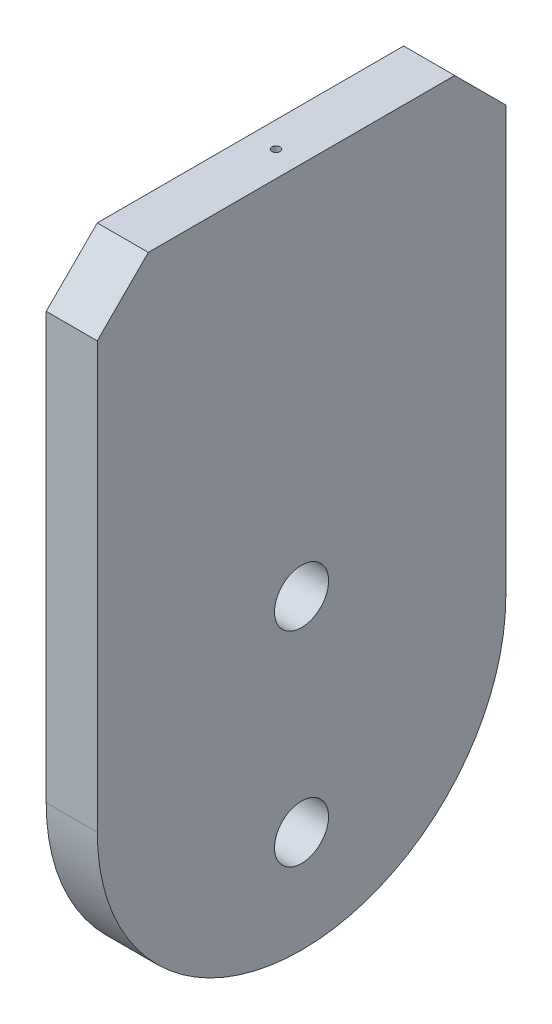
SolidWorks part; units mm, degrees
ref_plane "FRONT" through (0, 0, 0) normal (0, 0, 1) x (1, 0, 0)
ref_plane "TOP" through (0, 0, 0) normal (0, 1, 0) x (1, 0, 0)
ref_plane "RT-SIDE" through (0, 0, 0) normal (1, 0, 0) x (0, 0, -1)
sketch "Sketch1" plane through (0, 0, 0) normal (1, 0, 0) x (0, 0, -1)
  line L0 (0, 0) -> (0, 87.4268) construction
  line L1 (-38.1, 88.9) -> (38.1, 88.9)
  line L2 (38.1, 0) -> (38.1, 88.9)
  line L3 (-38.1, 0) -> (-38.1, 88.9)
  arc A1 (-38.1, 0) -> (38.1, 0) centre (0, 0) ccw
  point P10 (0, 88.9)
  dimension "D2" = 76.2
extrude "Base-Extrude" add sketch "Sketch1" along normal mid plane 9.525
chamfer "Chamfer1" distance 9.525 angle 45
sketch "Sketch2" plane through (0, 88.9, 0) normal (0, 1, 0) x (-1, 0, 0)
  line L0 (0, 28.575) -> (0, -28.575) construction
  line L1 (4.7625, 28.575) -> (-4.7625, 28.575) construction
  line L2 (-4.7625, -28.575) -> (4.7625, -28.575) construction
  circle A0 centre (0, 0) radius 0.762
  point P6 (0, 0)
  dimension "D1" = 1.524
extrude "Cut-Extrude1" cut sketch "Sketch2" against normal blind 6.35
sketch "Sketch3" plane through (4.7625, 0, 0) normal (1, 0, 0) x (0, 0, -1)
  line L0 (0, 0) -> (0, 88.9) construction
  line L1 (0, 82.55) -> (0, 88.9) construction
  line L2 (0, 0) -> (38.1, 0) construction
hole_wizard "3.8-Clearance" positions "Sketch5" profile "Sketch4" hole size "3/8" standard "Ansi Inch"
sketch "Sketch5" plane through (4.7625, 0, 0) normal (1, 0, 0) x (0, 0, -1)
  line L3 (0, 82.55) -> (0, 88.9) construction
  line L4 (0, 0) -> (0, -42.106) construction
  point P0 (0, -19.05)
  dimension "D1" = 19.05
sketch "Sketch4" plane through (4.7625, -19.05, 0) normal (0, 1, 0) x (0, 0, -1)
  line L0 (0, 0) -> (0, 9.525)
  line L1 (0, 9.525) -> (5.0419, 9.525)
  line L2 (5.0419, 9.525) -> (5.0419, 0)
  line L5 (5.0419, 0) -> (0, 0)
  line L11 (0, -6.35) -> (0, 107.95) construction
  dimension "Thru Hole Dia." = 10.0838
  dimension "Thru Hole Depth" = 9.525
pattern_linear "LPattern1" count 2 spacing 38.1 along (0, 1, 0)
